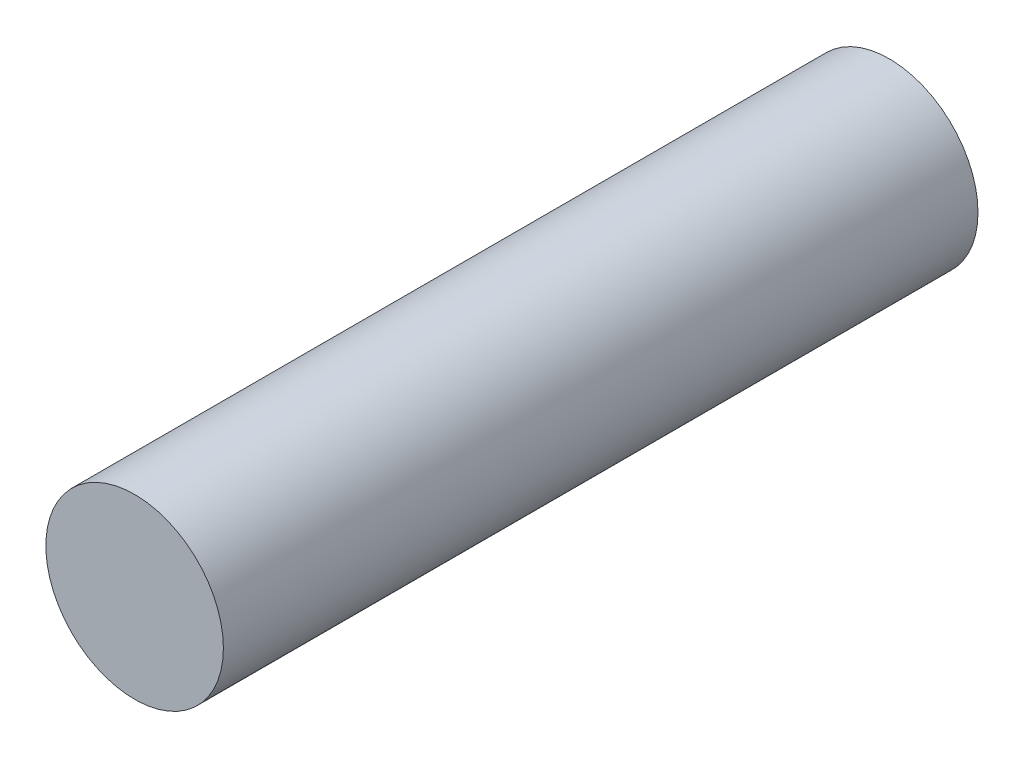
SolidWorks part; units mm, degrees
ref_plane "Front Plane" through (0, 0, 0) normal (0, 0, 1) x (1, 0, 0)
ref_plane "Top Plane" through (0, 0, 0) normal (0, 1, 0) x (1, 0, 0)
ref_plane "Right Plane" through (0, 0, 0) normal (1, 0, 0) x (0, 0, -1)
sketch "Sketch1" plane through (0, 0, 0) normal (0, 0, 1) x (1, 0, 0)
  circle A0 centre (0, 0) radius 2
  dimension "D1" = 4
extrude "Boss-Extrude1" add sketch "Sketch1" along normal mid plane 17
